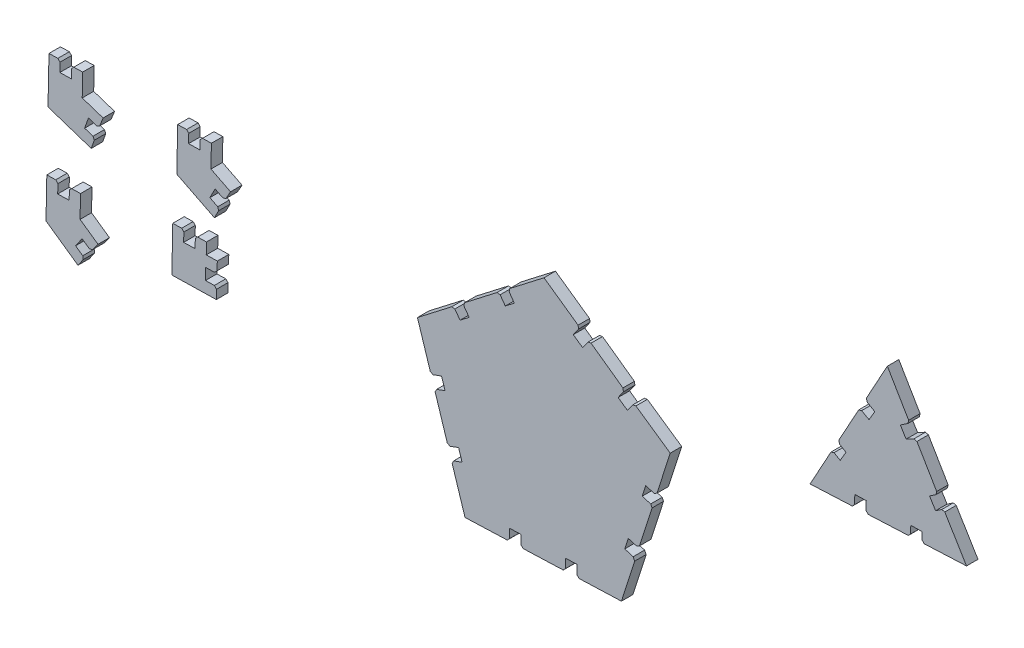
SolidWorks part; units mm, degrees
ref_plane "Front Plane" through (0, 0, 0) normal (0, 0, 1) x (1, 0, 0)
ref_plane "Top Plane" through (0, 0, 0) normal (0, 1, 0) x (1, 0, 0)
ref_plane "Right Plane" through (0, 0, 0) normal (1, 0, 0) x (0, 0, -1)
sketch "Sketch1" plane through (0, 0, 0) normal (0, 0, 1) x (1, 0, 0)
  line L0 (-111.287, 88.2781) -> (-118.381, 82.801)
  line L1 (-49.923, 4.3076) -> (-44.1347, 22.3334)
  line L2 (-28.6382, 70.8777) -> (-43.621, 81.2012)
  line L3 (-83.6884, 109.5857) -> (-98.6577, 98.0281)
  line L4 (-138.8856, 66.9705) -> (-133.282, 49.3618)
  line L5 (-118.141, 1.8227) -> (-99.7084, 2.4975)
  line L6 (-118.381, 82.801) -> (-104.193, 93.7553)
  line L7 (-102.8391, 93.5868) -> (-100.5747, 90.4795)
  line L8 (-100.5747, 90.4795) -> (-96.6354, 93.5209)
  line L9 (-98.0893, 95.5587) -> (-98.8795, 96.643)
  line L10 (-120.2979, 75.2523) -> (-122.5623, 78.3596)
  line L11 (-116.3384, 78.3086) -> (-120.2979, 75.2523)
  line L12 (-118.6027, 81.4159) -> (-116.3384, 78.3086)
  line L13 (-118.141, 1.8227) -> (-123.7446, 19.4314)
  line L14 (-123.9163, 78.5281) -> (-138.8856, 66.9705)
  line L15 (-49.2724, 85.1822) -> (-63.1818, 95.139)
  line L16 (-133.282, 49.3618) -> (-138.8856, 66.9705)
  line L17 (-130.5395, 44.0066) -> (-126.8426, 45.3605)
  line L18 (-126.8426, 45.3605) -> (-128.3659, 50.1274)
  line L19 (-128.3659, 50.1274) -> (-132.0629, 48.7735)
  line L20 (-119.4184, 22.0506) -> (-123.1153, 20.6967)
  line L21 (-120.9417, 26.8175) -> (-119.4184, 22.0506)
  line L22 (-124.6386, 25.4636) -> (-120.9417, 26.8175)
  line L23 (-131.1689, 42.7414) -> (-125.8578, 26.0519)
  line L24 (-118.141, 1.8227) -> (-123.7446, 19.4314)
  line L25 (-125.8578, 26.0519) -> (-131.1689, 42.7414)
  line L26 (-96.6354, 93.5209) -> (-98.0893, 95.5587)
  line L27 (-92.7672, 2.7454) -> (-75.2968, 3.385)
  line L28 (-75.2968, 3.385) -> (-92.7672, 2.7454)
  line L29 (-93.7322, 3.6959) -> (-93.7118, 7.6399)
  line L30 (-93.7118, 7.6399) -> (-98.7127, 7.4631)
  line L31 (-98.7127, 7.4631) -> (-98.7332, 3.5191)
  line L32 (-69.3001, 8.5273) -> (-69.3206, 4.5833)
  line L33 (-74.3011, 8.3505) -> (-69.3001, 8.5273)
  line L34 (-74.3216, 4.4065) -> (-74.3011, 8.3505)
  line L35 (-42.0454, 29.126) -> (-36.5592, 46.2108)
  line L36 (-49.923, 4.3076) -> (-44.1347, 22.3334)
  line L37 (-36.5592, 46.2108) -> (-42.0454, 29.126)
  line L38 (-43.2711, 28.4482) -> (-46.9554, 29.5319)
  line L39 (-46.9554, 29.5319) -> (-48.4841, 24.7697)
  line L40 (-48.4841, 24.7697) -> (-44.7998, 23.6861)
  line L41 (-39.3366, 53.2578) -> (-35.6523, 52.1741)
  line L42 (-40.8653, 48.4956) -> (-39.3366, 53.2578)
  line L43 (-37.181, 47.4119) -> (-40.8653, 48.4956)
  line L44 (-34.4266, 52.8519) -> (-28.6382, 70.8777)
  line L45 (-43.621, 81.2012) -> (-28.6382, 70.8777)
  line L46 (-49.923, 4.3076) -> (-44.1347, 22.3334)
  line L47 (-49.0649, 83.8128) -> (-51.3624, 80.5385)
  line L48 (-51.3624, 80.5385) -> (-47.2747, 77.6592)
  line L49 (-47.2747, 77.6592) -> (-44.9772, 80.9335)
  line L50 (-70.9232, 94.4763) -> (-68.6257, 97.7506)
  line L51 (-66.8355, 91.597) -> (-70.9232, 94.4763)
  line L52 (-64.538, 94.8712) -> (-66.8355, 91.597)
  line L53 (-49.2724, 85.1822) -> (-63.1818, 95.139)
  line L54 (-28.6382, 70.8777) -> (-34.4266, 52.8519)
  line L55 (-83.6884, 109.5857) -> (-68.8332, 99.12)
  line L56 (-63.1818, 95.139) -> (-49.2724, 85.1822)
  line L57 (-68.8332, 99.12) -> (-83.6884, 109.5857)
  line L58 (-36.5592, 46.2108) -> (-42.0454, 29.126)
  line L59 (-34.4266, 52.8519) -> (-28.6382, 70.8777)
  line L60 (-34.4266, 52.8519) -> (-28.6382, 70.8777)
  line L61 (-44.1347, 22.3334) -> (-49.923, 4.3076)
  line L62 (-42.0454, 29.126) -> (-36.5592, 46.2108)
  line L63 (-42.0454, 29.126) -> (-36.5592, 46.2108)
  line L64 (-92.7672, 2.7454) -> (-75.2968, 3.385)
  line L65 (-123.7446, 19.4314) -> (-118.141, 1.8227)
  line L66 (-125.8578, 26.0519) -> (-131.1689, 42.7414)
  line L67 (-131.1689, 42.7414) -> (-125.8578, 26.0519)
  line L68 (-133.282, 49.3618) -> (-138.8856, 66.9705)
  line L69 (-68.3556, 3.6328) -> (-49.923, 4.3076)
  line L70 (87.5626, 114.4827) -> (78.9476, 129.0849)
  line L71 (100.578, 92.8681) -> (91.0882, 108.5095)
  line L72 (66.0468, 151.0655) -> (56.9008, 134.4196)
  line L73 (32.3406, 89.7195) -> (50.7732, 90.5755)
  line L74 (32.3406, 89.7195) -> (51.7433, 90.6206)
  line L75 (51.7633, 91.607) -> (51.843, 95.5528)
  line L76 (51.843, 95.5528) -> (56.8461, 95.6519)
  line L77 (56.8461, 95.6519) -> (56.7688, 91.8292)
  line L78 (53.5305, 128.2856) -> (44.8569, 112.4994)
  line L79 (57.719, 90.8879) -> (75.1996, 91.6997)
  line L80 (76.257, 96.0609) -> (76.1897, 92.7312)
  line L81 (81.26, 96.16) -> (76.257, 96.0609)
  line L82 (81.1952, 92.9534) -> (81.26, 96.16)
  line L83 (82.1454, 92.012) -> (100.578, 92.8681)
  line L84 (89.7739, 108.7882) -> (87.0902, 106.9925)
  line L85 (87.0902, 106.9925) -> (84.4391, 111.2346)
  line L86 (84.4391, 111.2346) -> (87.2258, 113.0993)
  line L87 (78.9476, 129.0849) -> (87.5626, 114.4827)
  line L88 (74.2421, 127.595) -> (77.6482, 129.4265)
  line L89 (71.6944, 131.6826) -> (74.2421, 127.595)
  line L90 (74.9967, 133.8922) -> (71.6944, 131.6826)
  line L91 (57.2495, 133.068) -> (60.5696, 131.1659)
  line L92 (60.5696, 131.1659) -> (58.0584, 126.8434)
  line L93 (58.0584, 126.8434) -> (54.8419, 128.6861)
  line L94 (53.5305, 128.2856) -> (44.8569, 112.4994)
  line L95 (48.0073, 109.5427) -> (45.2055, 111.1478)
  line L96 (45.4961, 105.2202) -> (48.0073, 109.5427)
  line L97 (42.7979, 106.7659) -> (45.4961, 105.2202)
  line L98 (41.4866, 106.3653) -> (32.3406, 89.7195)
  line L143 (-284.8871, 86.6671) -> (-285.0865, 76.8027)
  line L144 (-285.0865, 76.8027) -> (-275.9804, 73.7844)
  line L145 (-299.5895, 86.3636) -> (-300.0023, 65.9449)
  line L146 (-300.0023, 65.9449) -> (-281.1533, 59.6973)
  line L147 (-299.5895, 86.3636) -> (-295.7098, 86.4453)
  line L148 (-294.7598, 85.4793) -> (-294.8395, 81.5336)
  line L149 (-294.8395, 81.5336) -> (-289.8365, 81.6327)
  line L150 (-289.8365, 81.6327) -> (-289.7567, 85.5784)
  line L151 (-288.7669, 86.5853) -> (-284.8871, 86.6671)
  line L152 (-275.9804, 73.7844) -> (-277.4675, 70.0447)
  line L153 (-278.7127, 69.4072) -> (-282.3551, 70.6145)
  line L154 (-282.3551, 70.6145) -> (-284.0332, 65.9032)
  line L155 (-284.0332, 65.9032) -> (-280.3907, 64.6959)
  line L156 (-279.8148, 63.4547) -> (-281.1533, 59.6973)
  line L157 (-228.7486, 87.8687) -> (-228.9481, 78.0043)
  line L158 (-228.9481, 78.0043) -> (-220.3963, 73.7081)
  line L159 (-243.4511, 87.5652) -> (-243.8338, 68.6335)
  line L160 (-243.8338, 68.6335) -> (-227.4214, 60.3882)
  line L161 (-243.4511, 87.5652) -> (-239.5713, 87.647)
  line L162 (-238.6213, 86.681) -> (-238.7011, 82.7352)
  line L163 (-238.7011, 82.7352) -> (-233.6981, 82.8343)
  line L164 (-233.6981, 82.8343) -> (-233.6183, 86.7801)
  line L165 (-232.6284, 87.7869) -> (-228.7486, 87.8687)
  line L166 (-220.3963, 73.7081) -> (-222.3821, 70.1584)
  line L167 (-223.6954, 69.6998) -> (-227.1161, 71.4183)
  line L168 (-227.1161, 71.4183) -> (-229.4067, 66.9773)
  line L169 (-229.4067, 66.9773) -> (-225.986, 65.2588)
  line L170 (-225.5889, 63.941) -> (-227.4214, 60.3882)
  line L171 (75.3335, 135.2756) -> (66.0468, 151.0655)
  line L172 (-285.824, 40.3244) -> (-286.0234, 30.46)
  line L173 (-286.0234, 30.46) -> (-278.1925, 24.9695)
  line L174 (-245.5986, 49.2013) -> (-245.9974, 29.4726)
  line L175 (-245.9974, 29.4726) -> (-226.5985, 29.8814)
  line L176 (-300.5264, 40.0209) -> (-300.8816, 22.4539)
  line L177 (-300.8816, 22.4539) -> (-286.9359, 12.6761)
  line L178 (-300.5264, 40.0209) -> (-296.6467, 40.1026)
  line L179 (-295.6966, 39.1366) -> (-295.7764, 35.1909)
  line L180 (-295.7764, 35.1909) -> (-290.7734, 35.29)
  line L181 (-290.7734, 35.29) -> (-290.6936, 39.2357)
  line L182 (-289.7037, 40.2426) -> (-285.824, 40.3244)
  line L183 (-278.1925, 24.9695) -> (-280.6364, 21.6936)
  line L184 (-281.9922, 21.4229) -> (-285.1245, 23.6191)
  line L185 (-285.1245, 23.6191) -> (-287.988, 19.5202)
  line L186 (-287.988, 19.5202) -> (-284.8556, 17.324)
  line L187 (-284.6452, 15.9551) -> (-286.9359, 12.6761)
  line L188 (-245.5986, 49.2013) -> (-241.7188, 49.2831)
  line L189 (-240.7688, 48.3171) -> (-240.8485, 44.3714)
  line L190 (-240.8485, 44.3714) -> (-235.8455, 44.4705)
  line L191 (-235.8455, 44.4705) -> (-235.7658, 48.4162)
  line L192 (-234.7759, 49.4231) -> (-230.8961, 49.5048)
  line L193 (-230.8961, 49.5048) -> (-230.9958, 44.5727)
  line L194 (-227.3382, 39.726) -> (-227.3399, 39.6438)
  line L195 (-230.9958, 44.5727) -> (-226.1461, 44.6749)
  line L196 (-226.1461, 44.6749) -> (-226.3807, 40.8032)
  line L197 (-227.3705, 39.7963) -> (-231.2503, 39.7146)
  line L198 (-231.2503, 39.7146) -> (-231.3485, 34.7114)
  line L199 (-231.3485, 34.7114) -> (-227.4688, 34.7932)
  line L200 (-226.5188, 33.8272) -> (-226.5985, 29.8814)
  line L201 (-133.282, 49.3618) -> (-132.0629, 48.7735)
  line L202 (-131.1689, 42.7414) -> (-130.5395, 44.0066)
  line L203 (-125.8578, 26.0519) -> (-124.6386, 25.4636)
  line L204 (-123.1153, 20.6967) -> (-123.7446, 19.4314)
  line L205 (-98.7332, 3.5191) -> (-99.7084, 2.4975)
  line L206 (-92.7672, 2.7454) -> (-93.7322, 3.6959)
  line L207 (-75.2968, 3.385) -> (-74.3216, 4.4065)
  line L208 (-69.3206, 4.5833) -> (-68.3556, 3.6328)
  line L209 (-44.7998, 23.6861) -> (-44.1347, 22.3334)
  line L210 (-42.0454, 29.126) -> (-43.2711, 28.4482)
  line L211 (-36.5592, 46.2108) -> (-37.181, 47.4119)
  line L212 (-35.6523, 52.1741) -> (-34.4266, 52.8519)
  line L213 (-122.5623, 78.3596) -> (-123.9163, 78.5281)
  line L214 (-118.381, 82.801) -> (-118.6027, 81.4159)
  line L215 (-104.193, 93.7553) -> (-102.8391, 93.5868)
  line L216 (-98.6577, 98.0281) -> (-98.8795, 96.643)
  line L217 (-68.8332, 99.12) -> (-68.6257, 97.7506)
  line L218 (-63.1818, 95.139) -> (-64.538, 94.8712)
  line L219 (-49.2724, 85.1822) -> (-49.0649, 83.8128)
  line L220 (-44.9772, 80.9335) -> (-43.621, 81.2012)
  line L221 (41.4866, 106.3653) -> (42.7979, 106.7659)
  line L222 (44.8569, 112.4994) -> (45.2055, 111.1478)
  line L223 (54.8419, 128.6861) -> (53.5305, 128.2856)
  line L224 (56.9008, 134.4196) -> (57.2495, 133.068)
  line L225 (74.9967, 133.8922) -> (75.3335, 135.2756)
  line L226 (77.6482, 129.4265) -> (78.9476, 129.0849)
  line L227 (91.0882, 108.5095) -> (89.7739, 108.7882)
  line L228 (87.2258, 113.0993) -> (87.5626, 114.4827)
  line L229 (81.1952, 92.9534) -> (82.1454, 92.012)
  line L230 (75.1996, 91.6997) -> (76.1897, 92.7312)
  line L231 (56.7688, 91.8292) -> (57.719, 90.8879)
  line L232 (50.7732, 90.5755) -> (51.7633, 91.607)
  line L249 (-295.7098, 86.4453) -> (-294.7598, 85.4793)
  line L250 (-289.7567, 85.5784) -> (-288.7669, 86.5853)
  line L251 (-277.4675, 70.0447) -> (-278.7127, 69.4072)
  line L252 (-280.3907, 64.6959) -> (-279.8148, 63.4547)
  line L253 (-290.6936, 39.2357) -> (-289.7037, 40.2426)
  line L254 (-296.6467, 40.1026) -> (-295.6966, 39.1366)
  line L255 (-280.6364, 21.6936) -> (-281.9922, 21.4229)
  line L256 (-284.8556, 17.324) -> (-284.6452, 15.9551)
  line L257 (-235.7658, 48.4162) -> (-234.7759, 49.4231)
  line L258 (-241.7188, 49.2831) -> (-240.7688, 48.3171)
  line L259 (-227.4688, 34.7932) -> (-226.5188, 33.8272)
  line L260 (-226.3807, 40.8032) -> (-227.3705, 39.7963)
  line L261 (-239.5713, 87.647) -> (-238.6213, 86.681)
  line L262 (-233.6183, 86.7801) -> (-232.6284, 87.7869)
  line L263 (-222.3821, 70.1584) -> (-223.6954, 69.6998)
  line L264 (-225.986, 65.2588) -> (-225.5889, 63.941)
  point P12 (44.147, 105.9931)
  point P69 (81.2276, 94.5567)
  point P95 (75.9451, 128.5108)
  point P250 (90.496, 109.4952)
  point P251 (56.5955, 90.8459)
  point P252 (76.0164, 91.7478)
  point P253 (80.8687, 91.9732)
  point P254 (75.8222, 134.4446)
  point P255 (56.4195, 133.5435)
  point P256 (41.9679, 107.2414)
  point P265 (-289.8901, 86.568)
  point P266 (-294.7398, 86.4658)
  point P267 (-277.8069, 69.0908)
  point P268 (-279.4801, 64.3941)
  point P269 (-233.7517, 87.7696)
  point P270 (-238.6014, 87.6674)
  point P271 (-222.8402, 69.2702)
  point P272 (-225.1308, 64.8292)
  point P273 (-281.2091, 20.8737)
  point P274 (-295.6767, 40.1231)
  point P275 (-290.827, 40.2253)
  point P276 (-284.0725, 16.7749)
  point P277 (-240.7488, 49.3035)
  point P278 (-235.8991, 49.4057)
  point P279 (-226.3991, 39.7458)
  point P280 (-226.4988, 34.8136)
  point P281 (-103.3768, 94.2158)
  point P282 (-99.4375, 97.2573)
  point P283 (-123.0797, 79.0034)
  point P284 (-98.787, 2.6661)
  point P285 (-69.675, 3.7319)
  dimension "D1" = 5
  dimension "D2" = 5
  dimension "D3" = 4.9989
  dimension "D4" = 4.9989
  dimension "D5" = 5
  dimension "D6" = 5
  dimension "D7" = 5
  dimension "D8" = 5
  dimension "D9" = 5
  dimension "D10" = 5
  dimension "D11" = 5
  dimension "D12" = 5
  dimension "D13" = 5
  dimension "D14" = 5
  dimension "D15" = 5
  dimension "D16" = 5
  dimension "D17" = 4.9966
  dimension "D18" = 5
  dimension "D19" = 5
  dimension "D20" = 5
  dimension "D21" = 5
  dimension "D22" = 5
  dimension "D23" = 5
  dimension "D24" = 5
extrude "Boss-Extrude1" add sketch "Sketch1" along normal blind 5 contours L220 L49 L48 L47 L219 L15 L218 L52 L51 L50 L217 L55 L3 L216 L9 L26 L8 L7 L215 L6 L0 L214 L12 L11 L10 L213 L14 L4 L201 L19 L18 L17 L202 L23 L203 L22 L21 L20 L204 L13 L5 L205 L31 L30 L29 L206 L27 L207 L34 L33 L32 | L73 L232 L75 L76 L77 L231 L79 L230 L80 L81 L82 L229 L83 L71 L227 L84 L85 L86 L228 L70 L226 L88 L89 L90 L225 L171 L72 L224 L91 L92 L93 L223 L78 L222 L95 L96 L97 L221 L98 | L264 L169 L168 L167 L263 L166 L158 L157 L165 L262 L164 L163 L162 L261 L161 L159 L160 L170 | L260 L196 L195 L193 L192 L257 L191 L190 L189 L258 L188 L174 L175 L200 L259 L199 L198 L197 | L252 L155 L154 L153 L251 L152 L144 L143 L151 L250 L150 L149 L148 L249 L147 L145 L146 L156 | L256 L186 L185 L184 L255 L183 L173 L172 L182 L253 L181 L180 L179 L254 L178 L176 L177 L187
